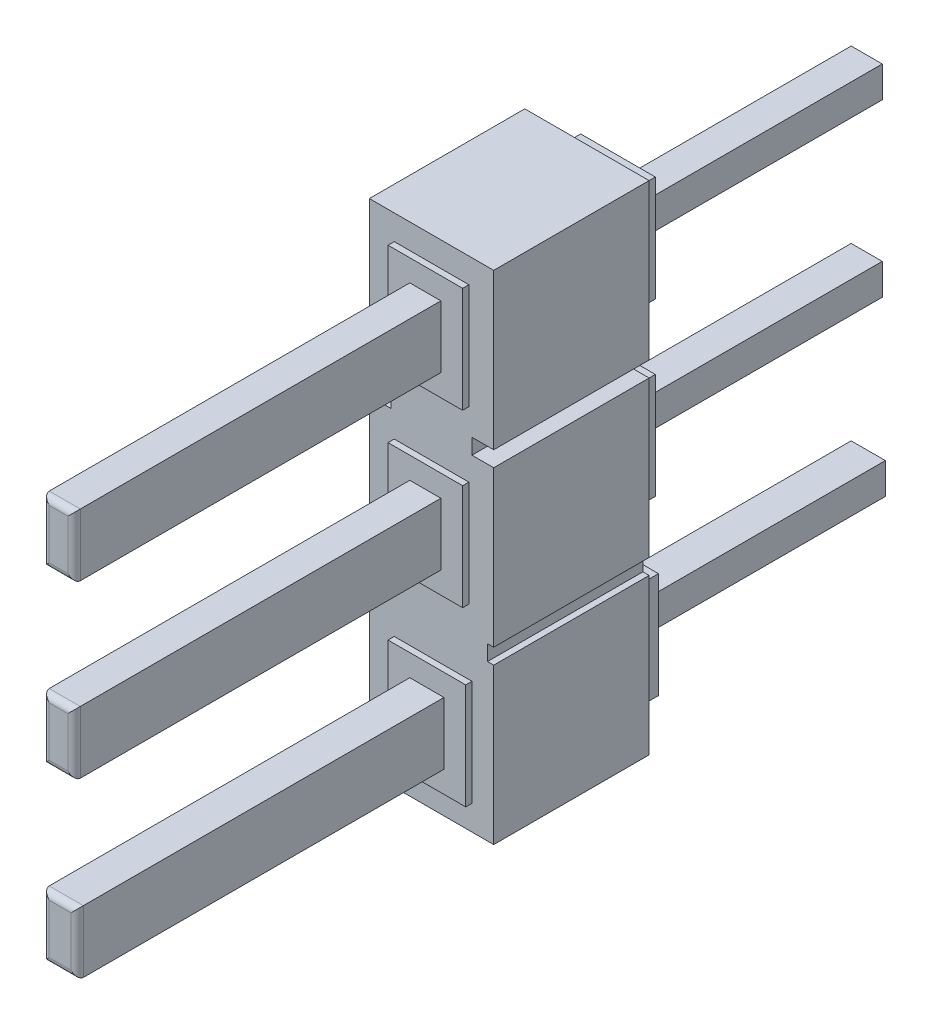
SolidWorks part; units mm, degrees
ref_plane "Plan de face" through (0, 0, 0) normal (0, 0, 1) x (1, 0, 0)
ref_plane "Plan de dessus" through (0, 0, 0) normal (0, 1, 0) x (1, 0, 0)
ref_plane "Plan de droite" through (0, 0, 0) normal (1, 0, 0) x (0, 0, -1)
sketch "Esquisse1" plane through (0, 0, 0) normal (0, 0, 1) x (1, 0, 0)
  line L0 (0, -4) -> (0, 5.1247) construction
  line L1 (-1, 4) -> (1, 4)
  line L2 (-1, 4) -> (-1, 1.5)
  line L3 (-1, -4) -> (1, -4)
  line L4 (1, 4) -> (1, 1.5)
  line L5 (1, -1.25) -> (0.9, -1.25)
  line L6 (1, -1.5) -> (1, -4)
  line L7 (1, -1.5) -> (0.9, -1.5)
  line L8 (0.9, -1.25) -> (0.9, -1.5)
  line L9 (1, 1.5) -> (0.65, 1.5)
  line L10 (-0.6, -0.85) -> (0.6, -0.85)
  line L11 (1, 1.25) -> (0.65, 1.25)
  line L12 (0.65, 1.5) -> (0.65, 1.25)
  line L13 (-1, -1.5) -> (-0.9, -1.5)
  line L14 (-0.9, -1.25) -> (-0.9, -1.5)
  line L15 (-1, -1.25) -> (-0.9, -1.25)
  line L16 (-1, 1.25) -> (-0.65, 1.25)
  line L17 (-0.65, 1.5) -> (-0.65, 1.25)
  line L18 (-1, 1.5) -> (-0.65, 1.5)
  line L19 (-1, -1.5) -> (-1, -4)
  line L20 (-1, 1.25) -> (-1, -1.25)
  line L21 (1, 1.25) -> (1, -1.25)
  line L22 (-0.6, 3.6) -> (0.6, 3.6)
  line L23 (-0.6, 3.6) -> (-0.6, 1.9)
  line L24 (-0.6, 1.9) -> (0.6, 1.9)
  line L25 (0.6, 3.6) -> (0.6, 1.9)
  line L26 (-0.6, 0.85) -> (-0.6, -0.85)
  line L27 (-0.6, 0.85) -> (0.6, 0.85)
  line L28 (0.6, 0.85) -> (0.6, -0.85)
  line L29 (-0.6, -3.6) -> (0.65, -3.6)
  line L30 (-0.6, -1.9) -> (-0.6, -3.6)
  line L31 (-0.6, -1.9) -> (0.65, -1.9)
  line L32 (0.65, -1.9) -> (0.65, -3.6)
  dimension "D1" = 8
  dimension "D2" = 2
  dimension "D3" = 4
  dimension "D4" = 1
  dimension "D5" = 0.35
  dimension "D6" = 0.1
  dimension "D7" = 0.25
  dimension "D8" = 0.25
  dimension "D9" = 2.5
  dimension "D10" = 2.5
  dimension "D11" = 0.4
  dimension "D12" = 0.4
  dimension "D13" = 0.4
  dimension "D14" = 0.4
  dimension "D15" = 0.4
  dimension "D16" = 0.35
  dimension "D17" = 0.4
  dimension "D18" = 0.4
  dimension "D19" = 0.4
extrude "Extrusion1" add sketch "Esquisse1" along normal blind 2.5
sketch "Esquisse2" plane through (0, 0, 0) normal (0, 0, -1) x (-1, 0, 0)
  line L0 (0.6, 3.6) -> (0.6, 1.9) construction
  line L1 (0.6, 3.6) -> (0.6, 1.9)
  line L2 (0.6, 1.9) -> (-0.6, 1.9) construction
  line L3 (0.6, 1.9) -> (-0.6, 1.9)
  line L4 (-0.6, 1.9) -> (-0.6, 3.6) construction
  line L5 (-0.6, 1.9) -> (-0.6, 3.6)
  line L6 (-0.6, 3.6) -> (0.6, 3.6) construction
  line L7 (-0.6, 3.6) -> (0.6, 3.6)
  line L8 (-0.6, 0.85) -> (0.6, 0.85) construction
  line L9 (-0.6, 0.85) -> (0.6, 0.85)
  line L10 (0.6, 0.85) -> (0.6, -0.85) construction
  line L11 (0.6, 0.85) -> (0.6, -0.85)
  line L12 (0.6, -0.85) -> (-0.6, -0.85) construction
  line L13 (0.6, -0.85) -> (-0.6, -0.85)
  line L14 (-0.65, -1.9) -> (0.6, -1.9) construction
  line L15 (-0.65, -1.9) -> (0.6, -1.9)
  line L16 (0.6, -1.9) -> (0.6, -3.6) construction
  line L17 (0.6, -1.9) -> (0.6, -3.6)
  line L18 (0.6, -3.6) -> (-0.65, -3.6) construction
  line L19 (0.6, -3.6) -> (-0.65, -3.6)
  line L20 (-0.65, -3.6) -> (-0.65, -1.9) construction
  line L21 (-0.65, -3.6) -> (-0.65, -1.9)
extrude "Extrusion2" add sketch "Esquisse2" along normal blind 4.5
sketch "Esquisse3" plane through (0, 0, -4.5) normal (0, 0, -1) x (-1, 0, 0)
  line L0 (-0.3, -2.25) -> (-0.3, -3.25)
  line L1 (-0.3, -3.25) -> (0.25, -3.25)
  line L2 (0.25, -3.25) -> (0.25, -2.25)
  line L3 (0.25, -2.25) -> (-0.3, -2.25)
  line L4 (0.6, -1.9) -> (-0.65, -1.9)
  line L5 (-0.65, -1.9) -> (-0.65, -3.6)
  line L6 (-0.65, -3.6) -> (0.6, -3.6)
  line L7 (0.6, -3.6) -> (0.6, -1.9)
  line L8 (0.6, -1.9) -> (-0.65, -1.9)
  line L9 (-0.65, -1.9) -> (-0.65, -3.6)
  line L10 (-0.65, -3.6) -> (0.6, -3.6)
  line L11 (0.6, -3.6) -> (0.6, -1.9)
  line L12 (0.6, 0.85) -> (-0.6, 0.85)
  line L13 (-0.6, 0.85) -> (-0.6, -0.85)
  line L14 (-0.6, -0.85) -> (0.6, -0.85)
  line L15 (0.6, -0.85) -> (0.6, 0.85)
  line L16 (0.6, 0.85) -> (-0.6, 0.85)
  line L17 (-0.6, 0.85) -> (-0.6, -0.85)
  line L18 (-0.6, -0.85) -> (0.6, -0.85)
  line L19 (0.6, -0.85) -> (0.6, 0.85)
  line L20 (0.6, 1.9) -> (0.6, 3.6)
  line L21 (0.6, 3.6) -> (-0.6, 3.6)
  line L22 (-0.6, 3.6) -> (-0.6, 1.9)
  line L23 (-0.6, 1.9) -> (0.6, 1.9)
  line L24 (0.6, 1.9) -> (0.6, 3.6)
  line L25 (0.6, 3.6) -> (-0.6, 3.6)
  line L26 (-0.6, 3.6) -> (-0.6, 1.9)
  line L27 (-0.6, 1.9) -> (0.6, 1.9)
  line L28 (-0.25, 0.5) -> (-0.25, -0.5)
  line L29 (-0.25, -0.5) -> (0.25, -0.5)
  line L30 (0.25, -0.5) -> (0.25, 0.5)
  line L31 (0.25, 0.5) -> (-0.25, 0.5)
  line L32 (-0.25, 3.25) -> (-0.25, 2.25)
  line L33 (-0.25, 2.25) -> (0.25, 2.25)
  line L34 (0.25, 2.25) -> (0.25, 3.25)
  line L35 (0.25, 3.25) -> (-0.25, 3.25)
  dimension "D1" = 0
  dimension "D2" = 0
  dimension "D3" = 0
  dimension "D4" = 0.35
  dimension "D5" = 0.35
extrude "Enlèv. mat.-Extru.1" cut sketch "Esquisse3" along direction (0, 0, 1) on the side against the normal blind 4
sketch "Esquisse4" plane through (0, 0, 0) normal (0, 0, 1) x (1, 0, 0)
  line L4 (-0.6, 3.6) -> (-0.6, 1.9)
  line L5 (-0.6, 1.9) -> (0.6, 1.9)
  line L6 (0.6, 1.9) -> (0.6, 3.6)
  line L7 (0.6, 3.6) -> (-0.6, 3.6)
  line L8 (-0.6, 3.6) -> (-0.6, 1.9)
  line L9 (-0.6, 1.9) -> (0.6, 1.9)
  line L10 (0.6, 1.9) -> (0.6, 3.6)
  line L11 (0.6, 3.6) -> (-0.6, 3.6)
  line L12 (0.6, 0.85) -> (-0.6, 0.85)
  line L13 (-0.6, 0.85) -> (-0.6, -0.85)
  line L14 (-0.6, -0.85) -> (0.6, -0.85)
  line L15 (0.6, -0.85) -> (0.6, 0.85)
  line L16 (0.6, 0.85) -> (-0.6, 0.85)
  line L17 (-0.6, 0.85) -> (-0.6, -0.85)
  line L18 (-0.6, -0.85) -> (0.6, -0.85)
  line L19 (0.6, -0.85) -> (0.6, 0.85)
  line L20 (0.65, -1.9) -> (-0.6, -1.9)
  line L21 (-0.6, -1.9) -> (-0.6, -3.6)
  line L22 (-0.6, -3.6) -> (0.65, -3.6)
  line L23 (0.65, -3.6) -> (0.65, -1.9)
  line L24 (0.65, -1.9) -> (-0.6, -1.9)
  line L25 (-0.6, -1.9) -> (-0.6, -3.6)
  line L26 (-0.6, -3.6) -> (0.65, -3.6)
  line L27 (0.65, -3.6) -> (0.65, -1.9)
  dimension "D1" = 0
  dimension "D2" = 0
  dimension "D3" = 0
extrude "Extrusion3" add sketch "Esquisse4" along normal blind 2.6
sketch "Esquisse5" plane through (0, 0, 2.6) normal (0, 0, 1) x (1, 0, 0)
  line L4 (-0.25, 3.25) -> (-0.25, 2.25)
  line L5 (0.25, 3.25) -> (-0.25, 3.25)
  line L6 (0.25, 2.25) -> (0.25, 3.25)
  line L7 (-0.25, 2.25) -> (0.25, 2.25)
  line L8 (-0.25, 3.25) -> (-0.25, 2.25)
  line L9 (0.25, 3.25) -> (-0.25, 3.25)
  line L10 (0.25, 2.25) -> (0.25, 3.25)
  line L11 (-0.25, 2.25) -> (0.25, 2.25)
  line L12 (-0.25, 0.5) -> (-0.25, -0.5)
  line L13 (0.25, 0.5) -> (-0.25, 0.5)
  line L14 (0.25, -0.5) -> (0.25, 0.5)
  line L15 (-0.25, -0.5) -> (0.25, -0.5)
  line L16 (-0.25, 0.5) -> (-0.25, -0.5)
  line L17 (0.25, 0.5) -> (-0.25, 0.5)
  line L18 (0.25, -0.5) -> (0.25, 0.5)
  line L19 (-0.25, -0.5) -> (0.25, -0.5)
  line L20 (-0.25, -2.25) -> (-0.25, -3.25)
  line L21 (0.3, -2.25) -> (-0.25, -2.25)
  line L22 (0.3, -3.25) -> (0.3, -2.25)
  line L23 (-0.25, -3.25) -> (0.3, -3.25)
  line L24 (-0.25, -2.25) -> (-0.25, -3.25)
  line L25 (0.3, -2.25) -> (-0.25, -2.25)
  line L26 (0.3, -3.25) -> (0.3, -2.25)
  line L27 (-0.25, -3.25) -> (0.3, -3.25)
  dimension "D1" = 0
  dimension "D2" = 0
  dimension "D3" = 0
extrude "Extrusion4" add sketch "Esquisse5" along normal blind 5.9
fillet "Congé1" radius 0.1 12 edges at (-0.25, 2.75, 8.5) (0, 3.25, 8.5) (0.25, 2.75, 8.5) (0, 2.25, 8.5) (-0.25, 0, 8.5) (0, 0.5, 8.5) (0.25, 0, 8.5) (0, -0.5, 8.5) (-0.25, -2.75, 8.5) (0.025, -2.25, 8.5) (0.3, -2.75, 8.5) (0.025, -3.25, 8.5)
sketch "Esquisse6" plane through (0, 0, -4.5) normal (0, 0, -1) x (-1, 0, 0)
  line L1 (-0.25, 3) -> (0.25, 3)
  line L2 (-0.25, 3) -> (-0.25, 2.5)
  line L3 (-0.25, 2.5) -> (0.25, 2.5)
  line L4 (0.25, 2.25) -> (0.25, 3.25)
  line L5 (0.25, 3.25) -> (-0.25, 3.25)
  line L6 (-0.25, 3.25) -> (-0.25, 2.25)
  line L7 (-0.25, 2.25) -> (0.25, 2.25)
  line L8 (0.25, 2.25) -> (0.25, 3.25)
  line L9 (0.25, 3.25) -> (-0.25, 3.25)
  line L10 (-0.25, 3.25) -> (-0.25, 2.25)
  line L11 (-0.25, 2.25) -> (0.25, 2.25)
  line L12 (0.25, -0.5) -> (0.25, 0.5)
  line L13 (0.25, 0.5) -> (-0.25, 0.5)
  line L14 (-0.25, 0.5) -> (-0.25, -0.5)
  line L15 (-0.25, -0.5) -> (0.25, -0.5)
  line L16 (0.25, -0.5) -> (0.25, 0.5)
  line L17 (0.25, 0.5) -> (-0.25, 0.5)
  line L18 (-0.25, 0.5) -> (-0.25, -0.5)
  line L19 (-0.25, -0.5) -> (0.25, -0.5)
  line L20 (0.25, -3.25) -> (0.25, -2.25)
  line L21 (0.25, -2.25) -> (-0.3, -2.25)
  line L22 (-0.3, -2.25) -> (-0.3, -3.25)
  line L23 (-0.3, -3.25) -> (0.25, -3.25)
  line L24 (0.25, -3.25) -> (0.25, -2.25)
  line L25 (0.25, -2.25) -> (-0.3, -2.25)
  line L26 (-0.3, -2.25) -> (-0.3, -3.25)
  line L27 (-0.3, -3.25) -> (0.25, -3.25)
  line L28 (0.25, 3) -> (0.25, 2.5)
  line L29 (-0.25, 0.25) -> (0.25, 0.25)
  line L30 (-0.25, 0.25) -> (-0.25, -0.25)
  line L31 (-0.25, -0.25) -> (0.25, -0.25)
  line L32 (0.25, 0.25) -> (0.25, -0.25)
  line L33 (-0.3, -2.5) -> (0.25, -2.5)
  line L34 (-0.3, -2.5) -> (-0.3, -3)
  line L35 (-0.3, -3) -> (0.25, -3)
  line L36 (0.25, -2.5) -> (0.25, -3)
  dimension "D4" = 0.5
  dimension "D5" = 0.25
  dimension "D6" = 0.5
  dimension "D7" = 0.25
  dimension "D8" = 0.25
  dimension "D9" = 0.5
  dimension "D1" = 0
  dimension "D2" = 0
  dimension "D3" = 0
extrude "Enlèv. mat.-Extru.2" cut sketch "Esquisse6" against normal up to surface (4 mm away) contours L35 L26 L27 L24 | L26 L33 L24 L25 | L31 L18 L19 L16 | L18 L29 L16 L17 | L1 M15 M13 M14 | L3 M15 M16 M13
